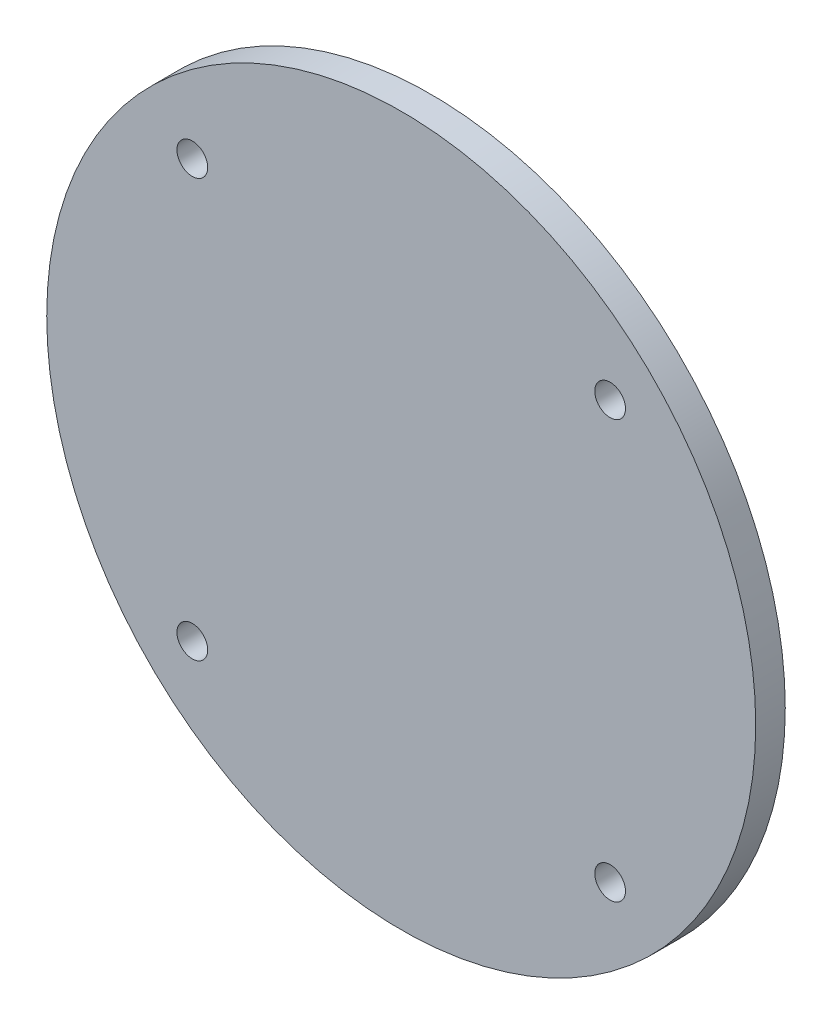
SolidWorks part; units mm, degrees
ref_plane "Front" through (0, 0, 0) normal (0, 0, 1) x (1, 0, 0)
ref_plane "Top" through (0, 0, 0) normal (0, 1, 0) x (1, 0, 0)
ref_plane "Right" through (0, 0, 0) normal (1, 0, 0) x (0, 0, -1)
sketch "Sketch2" plane through (0, 0, 0) normal (0, 0, 1) x (1, 0, 0)
  circle A0 centre (0, 0) radius 76.2
extrude "Extrude1" add sketch "Sketch2" along normal blind 6.35
sketch "Sketch3" plane through (0, 0, 6.35) normal (0, 0, 1) x (1, 0, 0)
  line L0 (0, 0) -> (0, 76.2) construction
  line L1 (0, 0) -> (-44.9013, 44.9013)
  line L2 (0, -76.2) -> (0, 0) construction
  line L3 (0, 0) -> (76.2, 0) construction
  line L4 (76.2, 0) -> (-76.2, 0) construction
  circle A0 centre (0, 0) radius 76.2 construction
  circle A1 centre (-44.9013, 44.9013) radius 3.302
  circle A2 centre (44.9013, 44.9013) radius 3.302
  circle A3 centre (44.9013, -44.9013) radius 3.302
  circle A4 centre (-44.9013, -44.9013) radius 3.302
  dimension "D1" = 45
  dimension "D2" = 63.5
extrude "Extrude2" cut sketch "Sketch3" against normal blind 6.35
